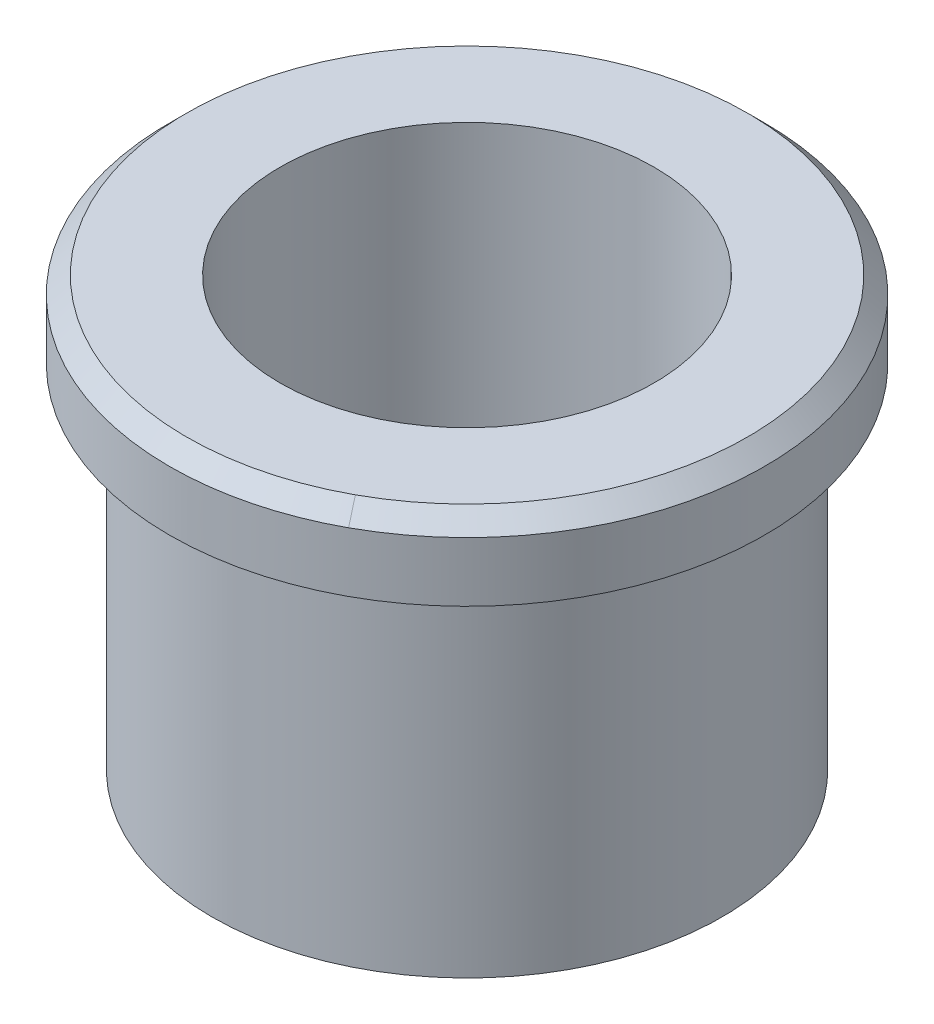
SolidWorks part; units mm, degrees
ref_plane "Plan de face" through (0, 0, 0) normal (0, 0, 1) x (1, 0, 0)
ref_plane "Plan de dessus" through (0, 0, 0) normal (0, 1, 0) x (1, 0, 0)
ref_plane "Plan de droite" through (0, 0, 0) normal (1, 0, 0) x (0, 0, -1)
imported_body "Importée1"
sketch "Esquisse1" plane through (0, -25.5, 0) normal (0, -1, 0) x (1, 0, 0)
  circle A0 centre (0, 0) radius 11 construction
  circle A1 centre (0, 0) radius 15
  circle A2 centre (0, 0) radius 15
  circle A3 centre (0, 0) radius 11
  dimension "D1" = 0
extrude "Enlèv. mat.-Extru.1" cut sketch "Esquisse1" against normal blind 0.3
